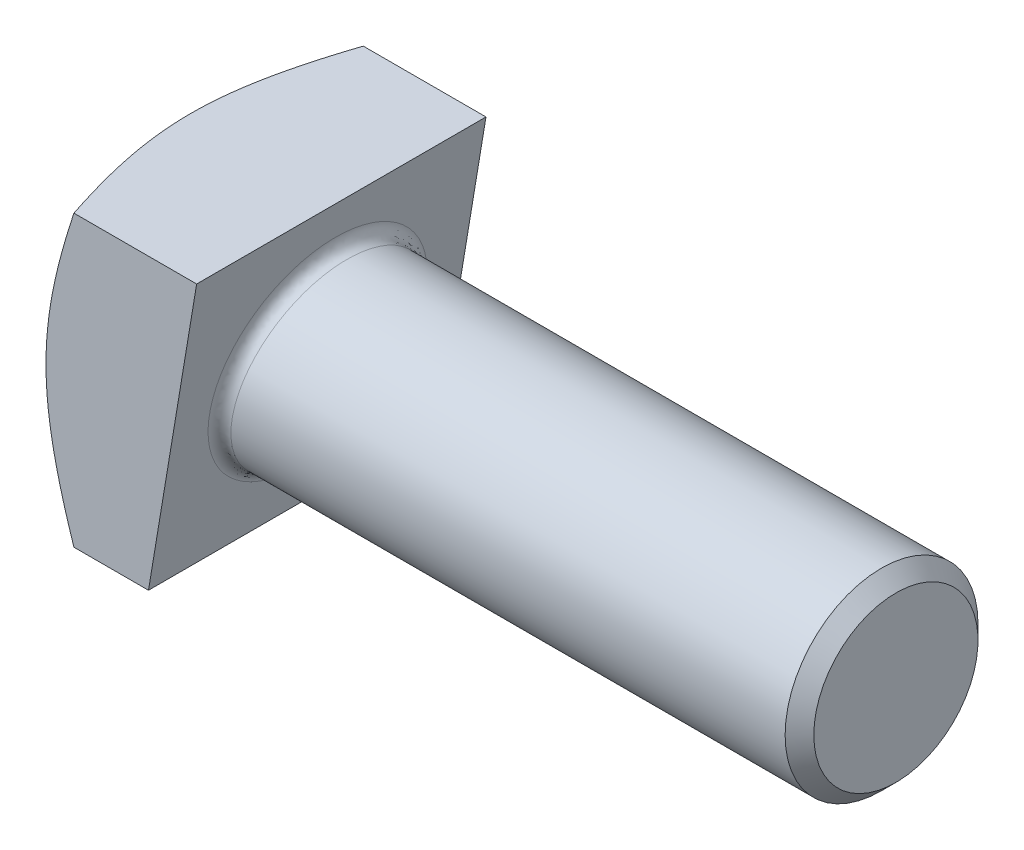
SolidWorks part; units mm, degrees
extrude "BaseHead" add sketch "Sketch1" along normal mid plane 38.1
sketch "Sketch1" plane through (0, 0, 0) normal (0, 0, 1) x (1, 0, 0)
  line L0 (0, -19.05) -> (0, 19.05)
  line L1 (0, 19.05) -> (19.8374, 19.05)
  line L2 (19.8374, 19.05) -> (13.4958, -19.05)
  line L3 (13.4958, -19.05) -> (0, -19.05)
ref_plane "Plane1" through (0, 0, 0) normal (0, 0, 1) x (1, 0, 0)
ref_plane "Plane2" through (0, 0, 0) normal (0, 1, 0) x (1, 0, 0)
ref_plane "Plane3" through (0, 0, 0) normal (1, 0, 0) x (0, 0, -1)
other "Configuration Table"
sketch "BodySke" plane through (0, 0, 0) normal (0, 0, 1) x (1, 0, 0)
  line L0 (0, 0) -> (0, 12.7)
  line L1 (0, 12.7) -> (90.9769, 12.7)
  line L2 (90.9769, 12.7) -> (92.8666, 10.8102)
  line L3 (92.8666, 10.8102) -> (92.8666, 0)
  line L4 (92.8666, 0) -> (0, 0)
  line L5 (0, -19.05) -> (0, 19.05) construction
  line L6 (0, 0) -> (101.6, 0) construction
  line L7 (90.9769, -12.7) -> (92.8666, -10.8102) construction
  line L8 (19.8374, 19.05) -> (13.4958, -19.05) construction
  line L9 (22.3774, 15.875) -> (22.3774, -3.175) construction
  line L10 (29.3666, 19.05) -> (29.3666, -3.175) construction
  point P11 (16.6666, 0)
revolve "Body" add sketch "BodySke" angle 360 about L6
ref_plane "Plane4" through (0, 0, 0) normal (0, -0.7071, 0.7071) x (1, 0, 0)
sketch "Sketch3" plane through (0, 0, 0) normal (0, -0.7071, 0.7071) x (1, 0, 0)
  line L0 (0, 19.05) -> (9.6016, 39.6408)
  line L1 (9.6016, 39.6408) -> (-6.35, 39.6408)
  line L2 (-6.35, 39.6408) -> (-6.35, 19.05)
  line L3 (-6.35, 19.05) -> (0, 19.05)
  line L4 (0, 0) -> (28.575, 0) construction
  line L5 (0, 0) -> (0, 26.9408) construction
  line L6 (-6.35, -19.05) -> (0, -19.05) construction
  line L7 (0, 26.9408) -> (19.8374, 26.9408) construction
revolve "HeadChamfer" cut sketch "Sketch3" angle 360 about L4
fillet "HeadFillet" radius 1.524 1 edges at (14.5528, -12.7, 0)
sketch "ThdSchSke" plane through (0, 0, 0) normal (0, 0, 1) x (1, 0, 0)
  line L0 (32.5374, -10.8102) -> (31.2142, -12.7)
  line L1 (32.5374, -10.8102) -> (33.8606, -12.7)
  line L2 (33.8606, -12.7) -> (33.8606, -15.875)
  line L3 (-3.175, 0) -> (5.1513, 0) construction
  line L5 (33.8606, -15.875) -> (31.2142, -15.875)
  line L6 (31.2142, -15.875) -> (31.2142, -12.7)
revolve "ThreadSchematic" [suppressed] cut sketch "ThdSchSke" angle 360 about L3
pattern_linear "ThdSchPat" [suppressed]
equation "\"D1@Sketch1\" = \"Width_flats@Sketch1\" / 2"
equation "\"D1@BaseHead\" = \"Width_flats@Sketch1\""
equation "\"Thread_minor@ThreadCosmetic\" = \"Minor_dia@BodySke\""
equation "\"D1@Sketch3\" =  \"Width_flats@Sketch1\""
equation "\"Thread_length@ThreadCosmetic\" = ((sgn( (\"Length@BodySke\" - \"Advance@BodySke\" ) - \"Thread_nom@BodySke\" )-1)*( (\"Length@BodySke\" - \"Advance@BodySke\" ) - \"Thread_nom@BodySke\" ))/-2+ \"Thread_nom@BodySke\""
equation "\"Thread_minor@ThdSchSke\" = \"Minor_dia@BodySke\""
equation "\"Diameter@ThdSchSke\" = \"Diameter@BodySke\""
equation "\"Overcut@ThdSchSke\" = \"Diameter@BodySke\" * 1.25"
equation "\"Start@ThdSchSke\" = \"Head_ht@Sketch1\" + \"Length@BodySke\" - \"Thread_length@ThreadCosmetic\"  '---Non-countersunk---"
equation "\"Num_threads@ThdSchPat\" = int( \"Thread_length@ThreadCosmetic\" / \"Advance@BodySke\" + 0.999 )  + 1"
equation "\"Advance@ThdSchPat\" = \"Thread_length@ThreadCosmetic\" /  (\"Num_threads@ThdSchPat\" - 1) 'relax it"
equation "\"Num_threads@ThdSchPat\" = \"Num_threads@ThdSchPat\" - sgn( \"Num_threads@ThdSchPat\" - 1) '---chamfered tips only---"
